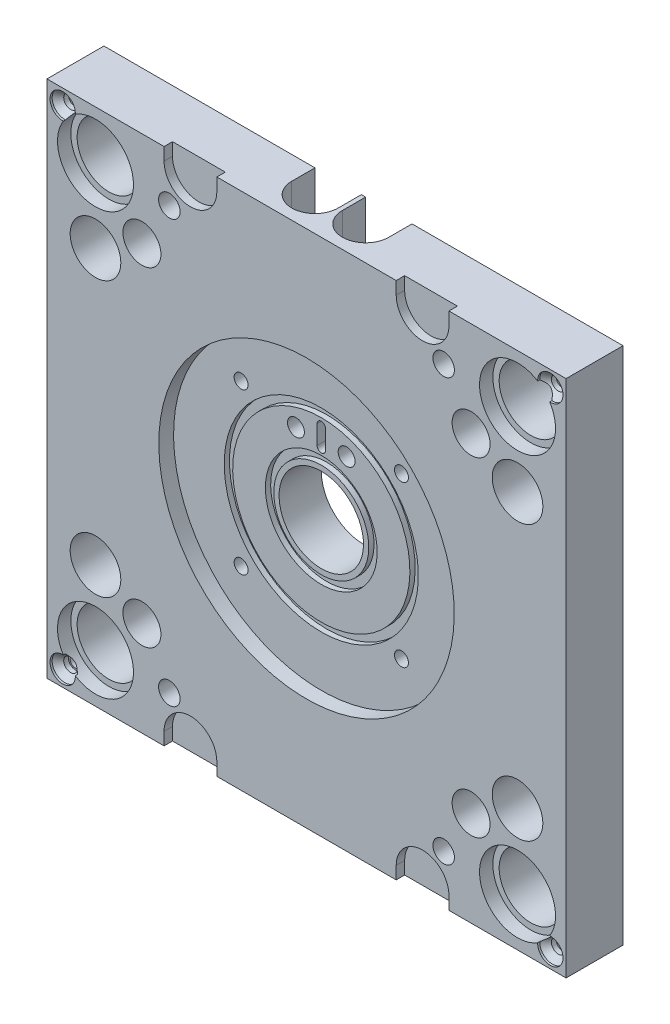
SolidWorks part; units mm, degrees
ref_plane "Plan de face" through (0, 0, 0) normal (0, 0, 1) x (1, 0, 0)
ref_plane "Plan de dessus" through (0, 0, 0) normal (0, 1, 0) x (1, 0, 0)
ref_plane "Plan de droite" through (0, 0, 0) normal (1, 0, 0) x (0, 0, -1)
sketch "Esquisse1" plane through (0, 0, 0) normal (0, 0, 1) x (1, 0, 0)
  line L1 (-123, 123) -> (123, 123)
  line L2 (-123, 123) -> (-123, -123)
  line L3 (-123, -123) -> (123, -123)
  line L4 (123, 123) -> (123, -123)
  dimension "D1" = 246
  dimension "D2" = 246
  dimension "D3" = 123
  dimension "D4" = 123
extrude "ExtrusionPlaque" add sketch "Esquisse1" along normal blind 27
sketch "Esquisse2" plane through (0, 0, 0) normal (1, 0, 0) x (0, 0, -1)
  line L0 (2.3658, 0) -> (-28.3416, 0) construction
  line L1 (0, 20) -> (-20, 20)
  line L2 (0, -123) -> (0, 123) construction
  line L3 (-20, 20) -> (-20, 22.5)
  line L4 (-20, 22.5) -> (-17.5, 22.5)
  line L5 (-17.5, 22.5) -> (-17.5, 26.5)
  line L6 (-17.5, 26.5) -> (-20, 26.5)
  line L7 (-20, 26.5) -> (-20, 42)
  line L8 (-20, 42) -> (-17.5, 42)
  line L9 (-17.5, 42) -> (-17.5, 46)
  line L10 (-17.5, 46) -> (-20, 46)
  line L11 (-20, 46) -> (-20, 70)
  line L12 (-20, 70) -> (-27, 70)
  line L13 (-27, -123) -> (-27, 123) construction
  line L14 (-27, 70) -> (-27, 0)
  line L15 (0, 0) -> (-27, 0)
  line L16 (0, 0) -> (0, 20)
  dimension "D1" = 40
  dimension "D2" = 7
  dimension "D3" = 2.5
  dimension "D4" = 45
  dimension "D5" = 53
  dimension "D6" = 140
  dimension "D7" = 92
  dimension "D8" = 84
revolve "LogementBlocEtJoints" cut sketch "Esquisse2" angle 360 about L0
hole_wizard "ChambrageDouille" positions "Esquisse4" profile "Esquisse3" counterbore size "24" standard "HASCO Metric"
sketch "Esquisse4" plane through (0, 0, 27) normal (0, 0, 1) x (1, 0, 0)
  point P0 (-100, 100)
sketch "Esquisse3" plane through (-100, 100, 27) normal (1, 0, 0) x (0, -1, 0)
  line L0 (0, 0) -> (0, 27)
  line L1 (0, 27) -> (15, 27)
  line L3 (15, 27) -> (15, 6.3)
  line L4 (15, 6.3) -> (18, 6.3)
  line L5 (18, 6.3) -> (18, 0)
  line L7 (18, 0) -> (0, 0)
  line L11 (0, -6.35) -> (0, 107.95) construction
  dimension "Diamètre du perçage jusqu'au prochain" = 30
  dimension "Profondeur du perçage jusqu'au prochain" = 27
  dimension "Diamètre du chambrage" = 36
  dimension "Profondeur du chambrage" = 6.3
pattern_linear "RépétitionChamDouille" count 2 spacing 200 along (1, 0, 0) count 2 spacing 200 along (0, -1, 0) of "ChambrageDouille"
hole_wizard "Chambrage pour Vis épaulée 16 mm1" positions "Esquisse6" profile "Esquisse5" counterbore size "16" standard "HASCO Metric"
sketch "Esquisse6" plane through (0, 0, 27) normal (0, 0, 1) x (1, 0, 0)
  point P0 (-100, 65)
sketch "Esquisse5" plane through (-100, 65, 27) normal (1, 0, 0) x (0, -1, 0)
  line L0 (0, 0) -> (0, 27)
  line L1 (0, 27) -> (8.5, 27)
  line L3 (8.5, 27) -> (8.5, 17)
  line L4 (8.5, 17) -> (12, 17)
  line L5 (12, 17) -> (12, 0)
  line L7 (12, 0) -> (0, 0)
  line L11 (0, -6.35) -> (0, 107.95) construction
  dimension "Diamètre du perçage jusqu'au prochain" = 17
  dimension "Profondeur du perçage jusqu'au prochain" = 27
  dimension "Diamètre du chambrage" = 24
  dimension "Profondeur du chambrage" = 17
pattern_linear "RépétitionChambrage" count 2 spacing 200 along (1, 0, 0) count 2 spacing 130 along (0, -1, 0) of "Chambrage pour Vis épaulée 16 mm1"
hole_wizard "Fraisage pour vis à tête fraisée M101" positions "Esquisse8" profile "Esquisse7" countersink size "M10" standard "HASCO Metric"
sketch "Esquisse8" plane through (0, 0, 27) normal (0, 0, 1) x (1, 0, 0)
  point P0 (-115.555, 115.555)
sketch "Esquisse7" plane through (-115.555, 115.555, 27) normal (1, 0, 0) x (0, -1, 0)
  line L0 (0, 0) -> (0, 6)
  line L1 (0, 6) -> (3.25, 6)
  line L2 (3.25, 6) -> (3.25, 3.75)
  line L3 (3.25, 3.75) -> (6, 1)
  line L4 (6, 1) -> (6, 0)
  line L6 (6, 0) -> (0, 0)
  line L7 (-3.25, 3.75) -> (-6, 1) construction
  line L10 (0, 6) -> (-3.25, 6) construction
  line L11 (0, -6.35) -> (0, 107.95) construction
  dimension "Diamètre du perçage" = 6.5
  dimension "Profondeur du perçage" = 6
  dimension "Diamètre du fraisage" = 12
  dimension "Angle du fraisage" = 90
  dimension "Angle de pointe" = 180
  dimension "Dégagement de la tête" = 1
hole_wizard "Trou taraudé M6x1.01" positions "Esquisse10" profile "Esquisse9" tap size "M6x1.0" standard "HASCO Metric"
sketch "Esquisse10" plane through (0, 0, 21) normal (0, 0, 1) x (1, 0, 0)
  point P0 (-115.555, 115.555)
sketch "Esquisse9" plane through (-115.555, 115.555, 21) normal (1, 0, 0) x (0, -1, 0)
  line L0 (0, 0) -> (0, 22.4434)
  line L1 (0, 22.4434) -> (2.5, 21)
  line L2 (2.5, 21) -> (2.5, 0)
  line L5 (2.5, 0) -> (0, 0)
  line L10 (0, 22.4434) -> (-2.5, 21) construction
  line L11 (0, -6.35) -> (0, 107.95) construction
  dimension "Diamètre du trou pour taraudage" = 5
  dimension "Profondeur du trou pour taraudage" = 21
  dimension "Angle de pointe" = 120
pattern_linear "RépétitionTrouTaraudFraisure" count 2 spacing 231.11 along (1, 0, 0) count 2 spacing 231.11 along (0, -1, 0) of "Fraisage pour vis à tête fraisée M101", "Trou taraudé M6x1.01"
hole_wizard "DégagementTirant" positions "Esquisse12" profile "Esquisse11" hole size "M16" standard "ISO"
sketch "Esquisse12" plane through (0, 0, 27) normal (0, 0, 1) x (1, 0, 0)
  point P0 (-78, 78)
sketch "Esquisse11" plane through (-78, 78, 27) normal (1, 0, 0) x (0, -1, 0)
  line L0 (0, 0) -> (0, 27)
  line L1 (0, 27) -> (9, 27)
  line L2 (9, 27) -> (9, 0)
  line L5 (9, 0) -> (0, 0)
  line L11 (0, -6.35) -> (0, 107.95) construction
  dimension "Diamètre du perçage jusqu'au prochain" = 18
  dimension "Profondeur du perçage jusqu'au prochain" = 27
pattern_linear "RépétitionDégTirant" count 2 spacing 156 along (1, 0, 0) count 2 spacing 156 along (0, -1, 0) of "DégagementTirant"
hole_wizard "TaraudageTirant" positions "Esquisse14" profile "Esquisse13" tap size "M12x1.75" standard "HASCO Metric"
sketch "Esquisse14" plane through (0, 0, 27) normal (0, 0, 1) x (1, 0, 0)
  point P0 (-65, 100)
sketch "Esquisse13" plane through (-65, 100, 27) normal (1, 0, 0) x (0, -1, 0)
  line L0 (0, 0) -> (0, 27.9445)
  line L1 (0, 27.9445) -> (5.1, 25)
  line L2 (5.1, 25) -> (5.1, 0)
  line L5 (5.1, 0) -> (0, 0)
  line L10 (0, 27.9445) -> (-5.1, 25) construction
  line L11 (0, -6.35) -> (0, 107.95) construction
  dimension "Diamètre du trou pour taraudage" = 10.2
  dimension "Profondeur du trou pour taraudage" = 25
  dimension "Angle de pointe" = 120
pattern_linear "RépétitionTaraudTirant" count 2 spacing 130 along (1, 0, 0) count 2 spacing 200 along (0, -1, 0) of "TaraudageTirant"
sketch "Esquisse15" plane through (0, 0, 27) normal (0, 0, 1) x (1, 0, 0)
  line L0 (-42.5, 117) -> (-42.5, 123)
  line L1 (123, 123) -> (-123, 123) construction
  line L2 (-42.5, 123) -> (-67.5, 123)
  line L3 (-67.5, 123) -> (-67.5, 117)
  arc A0 (-67.5, 117) -> (-42.5, 117) centre (-55, 117) ccw
extrude "EncocheDécollementPlaques" cut sketch "Esquisse15" against normal blind 4
pattern_linear "RépétitionEncoche" count 2 spacing 110 along (1, 0, 0) of "EncocheDécollementPlaques"
mirror "SymétrieEncoches" about plane through (0, 0, 0) normal (0, 1, 0) of "RépétitionEncoche", "EncocheDécollementPlaques"
hole_wizard "Perçage8Régul" positions "Esquisse17" profile "Esquisse16" hole size "8" standard "HASCO Metric"
sketch "Esquisse17" plane through (0, 0, 20) normal (0, 0, 1) x (1, 0, 0)
  point P0 (-12, 32)
  dimension "D1" = 32
sketch "Esquisse16" plane through (-12, 32, 20) normal (1, 0, 0) x (0, -1, 0)
  line L0 (0, 0) -> (0, 13)
  line L1 (0, 13) -> (4, 13)
  line L2 (4, 13) -> (4, 0)
  line L5 (4, 0) -> (0, 0)
  line L10 (0, 13) -> (-4, 13) construction
  line L11 (0, -6.35) -> (0, 107.95) construction
  dimension "Diamètre du perçage" = 8
  dimension "Profondeur du perçage" = 13
  dimension "Angle de pointe" = 180
pattern_linear "RépétitionPerçRégul" count 2 spacing 24 along (1, 0, 0) of "Perçage8Régul"
sketch "Esquisse18" plane through (0, 0, 20) normal (0, 0, 1) x (1, 0, 0)
  line L2 (2, 38.5) -> (2, 29.5)
  line L4 (-2, 38.5) -> (-2, 29.5)
  arc A0 (2, 38.5) -> (-2, 38.5) centre (0, 38.5) ccw
  arc A1 (-2, 29.5) -> (2, 29.5) centre (0, 29.5) ccw
  dimension "D3" = 29.5
  dimension "D1" = 9
  dimension "D2" = 4
  dimension "D4" = 2
extrude "LogementBochonSéparation" cut sketch "Esquisse18" against normal blind 4
hole_wizard "ChambrageVisFixationBloc" positions "Esquisse20" profile "Esquisse19" counterbore size "M6" standard "HASCO Metric"
sketch "Esquisse20" plane through (0, 0, 0) normal (0, 0, -1) x (-1, 0, 0)
  point P0 (38, 38)
sketch "Esquisse19" plane through (-38, 38, 0) normal (1, 0, 0) x (0, 1, 0)
  line L0 (0, 0) -> (0, 27)
  line L1 (0, 27) -> (3.3, 27)
  line L3 (3.3, 27) -> (3.3, 6)
  line L4 (3.3, 6) -> (5.5, 6)
  line L5 (5.5, 6) -> (5.5, 0)
  line L7 (5.5, 0) -> (0, 0)
  line L11 (0, -6.35) -> (0, 107.95) construction
  dimension "Diamètre du perçage jusqu'au prochain" = 6.6
  dimension "Profondeur du perçage jusqu'au prochain" = 27
  dimension "Diamètre du chambrage" = 11
  dimension "Profondeur du chambrage" = 6
pattern_linear "RépétitionChamVisBloc" count 2 spacing 76 along (1, 0, 0) count 2 spacing 76 along (0, -1, 0) of "ChambrageVisFixationBloc"
sketch "Esquisse21" plane through (0, 123, 0) normal (0, 1, 0) x (-1, 0, 0)
  line L0 (-123, 0) -> (123, 0) construction
  line L1 (1, 11) -> (1, 0)
  line L2 (1, 0) -> (23, 0)
  line L3 (23, 0) -> (23, 11)
  arc A0 (23, 11) -> (1, 11) centre (12, 11) ccw
  dimension "D3" = 22
  dimension "D1" = 11
  dimension "D2" = 12
extrude "LamageRaccords" cut sketch "Esquisse21" against normal blind 23
hole_wizard "TaraudageRaccordsCircuitRégul" positions "2" profile "3" counterbore size "8" standard "HASCO Metric"
sketch "2" plane through (0, 100, 0) normal (0, 1, 0) x (-1, 0, 0)
  point P0 (12, 11)
sketch "3" plane through (-12, 100, 11) normal (1, 0, 0) x (0, 0, 1)
  line L0 (0, 0) -> (0, 84)
  line L1 (0, 84) -> (4, 84)
  line L3 (4, 84) -> (4, 13)
  line L4 (4, 13) -> (5.75, 13)
  line L5 (5.75, 13) -> (5.75, 0)
  line L7 (5.75, 0) -> (0, 0)
  line L11 (0, -6.35) -> (0, 107.95) construction
  dimension "Diamètre du perçage jusqu'au prochain" = 8
  dimension "Profondeur du perçage jusqu'au prochain" = 84
  dimension "Diamètre du chambrage" = 11.5
  dimension "Profondeur du chambrage" = 13
mirror "SymétrieTarRaccordCircuitRégul" about plane through (0, 0, 0) normal (1, 0, 0) of "TaraudageRaccordsCircuitRégul", "LamageRaccords"
